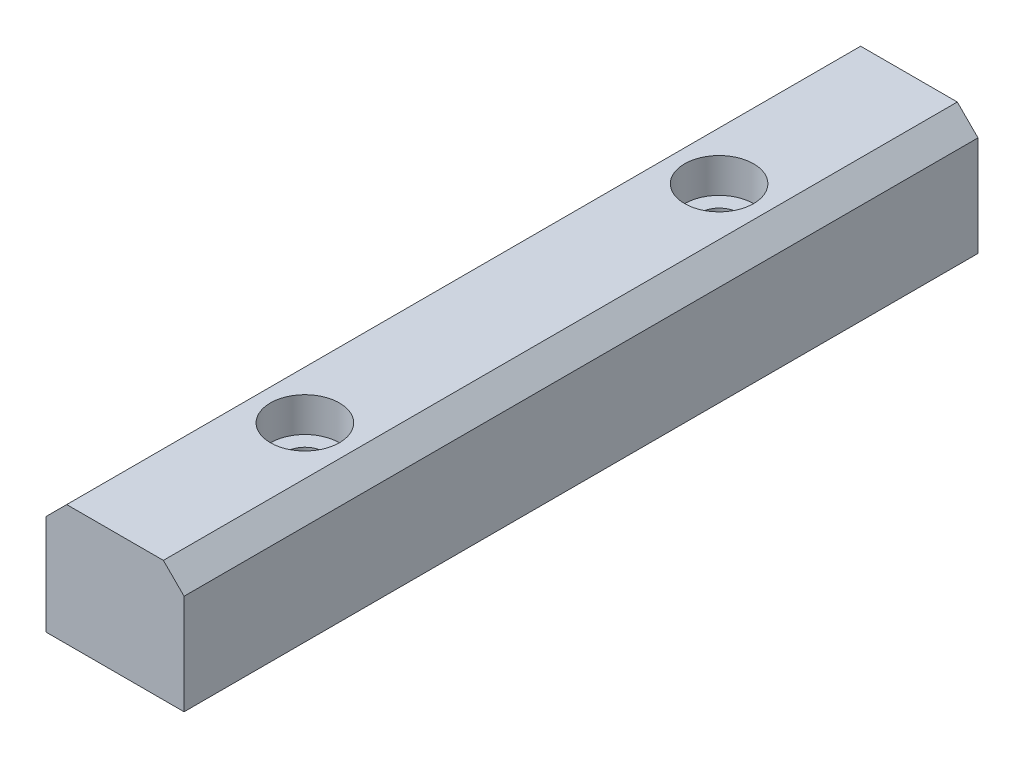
SolidWorks part; units mm, degrees
ref_plane "Ebene vorne" through (0, 0, 0) normal (0, 0, 1) x (1, 0, 0)
ref_plane "Ebene oben" through (0, 0, 0) normal (0, 1, 0) x (1, 0, 0)
ref_plane "Ebene rechts" through (0, 0, 0) normal (1, 0, 0) x (0, 0, -1)
sketch "Skizze1" plane through (0, 0, 0) normal (0, 1, 0) x (1, 0, 0)
  line L0 (10, 57.5) -> (-10, -57.5) construction
  line L1 (-10, 57.5) -> (10, 57.5)
  line L2 (-10, 57.5) -> (-10, -57.5)
  line L3 (-10, -57.5) -> (10, -57.5)
  line L4 (10, 57.5) -> (10, -57.5)
  dimension "D1" = 20
  dimension "D2" = 115
extrude "Linear austragen1" add sketch "Skizze1" along normal blind 17.5
hole_wizard "Stirnsenkung für M5 Zylinderschraube mit Innensechskant1" positions "Skizze3" profile "Skizze2" counterbore size "M5" standard "Ansi Metrisch"
sketch "Skizze3" plane through (0, 17.5, 0) normal (0, 1, 0) x (-1, 0, 0)
  line L0 (10, 57.5) -> (-10, 57.5) construction
  line L1 (-10, -57.5) -> (10, -57.5) construction
  point P0 (0, 30)
  point P1 (0, -30)
  dimension "D1" = 27.5
  dimension "D2" = 27.5
  dimension "D3" = 60
sketch "Skizze2" plane through (0, 17.5, 30) normal (1, 0, 0) x (0, 0, 1)
  line L0 (0, 0) -> (0, 17.5)
  line L1 (0, 17.5) -> (2.75, 17.5)
  line L3 (2.75, 17.5) -> (2.75, 5)
  line L4 (2.75, 5) -> (5, 5)
  line L5 (5, 5) -> (5, 0)
  line L7 (5, 0) -> (0, 0)
  line L11 (0, -6.35) -> (0, 107.95) construction
  dimension "Bohrerdurchmesser" = 5.5
  dimension "Bohrungstiefe" = 17.5
  dimension "Senkdurchmesser2" = 10
  dimension "Senktiefe2" = 5
chamfer "Fase1" distance 3 angle 45 2 edges at (-10, 17.5, 0) (10, 17.5, 0)
